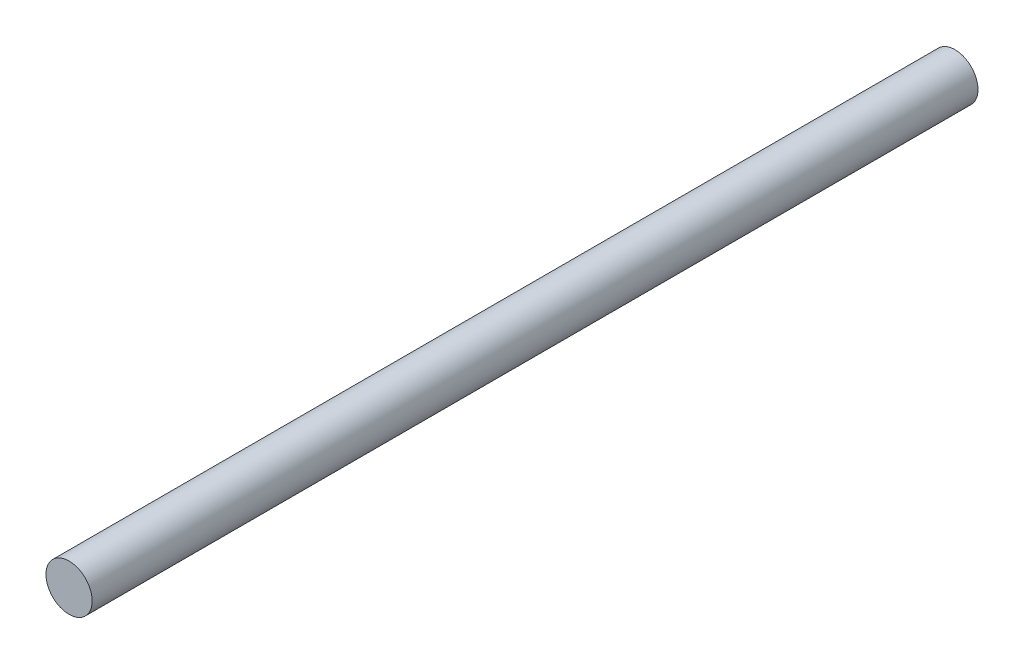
SolidWorks part; units mm, degrees
ref_plane "Front Plane" through (0, 0, 0) normal (0, 0, 1) x (1, 0, 0)
ref_plane "Top Plane" through (0, 0, 0) normal (0, 1, 0) x (1, 0, 0)
ref_plane "Right Plane" through (0, 0, 0) normal (1, 0, 0) x (0, 0, -1)
sketch "Sketch1" plane through (0, 0, 0) normal (0, 0, 1) x (1, 0, 0)
  circle A0 centre (0, 0) radius 30
  dimension "D1" = 60
extrude "Boss-Extrude1" add sketch "Sketch1" against normal blind 1150
